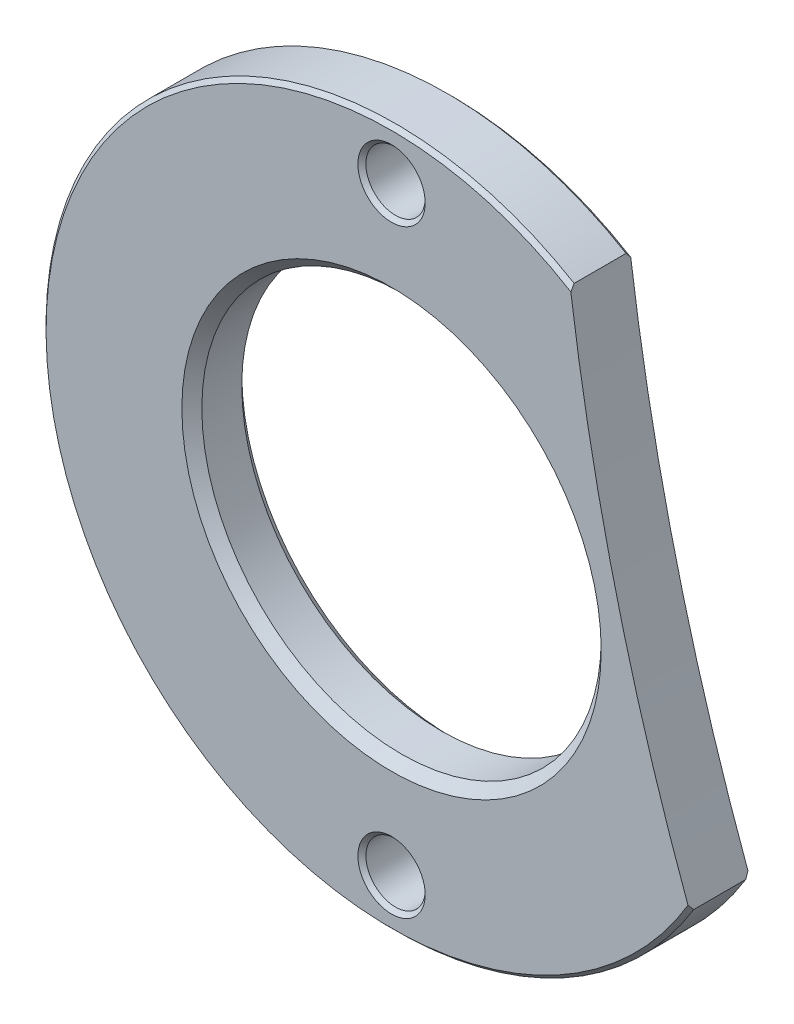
SolidWorks part; units mm, degrees
ref_plane "Plan de face" through (0, 0, 0) normal (0, 0, 1) x (1, 0, 0)
ref_plane "Plan de dessus" through (0, 0, 0) normal (0, 1, 0) x (1, 0, 0)
ref_plane "Plan de droite" through (0, 0, 0) normal (1, 0, 0) x (0, 0, -1)
sketch "Esquisse1" plane through (0, 0, 0) normal (0, 0, 1) x (1, 0, 0)
  circle A0 centre (0, 0) radius 10
  arc A1 (8.9458, 15.0407) -> (14.9354, -9.1206) centre (0, 0) ccw
  arc A2 (8.9458, 15.0407) -> (14.9354, -9.1206) centre (119, 29.5) ccw
  dimension "D1" = 20
  dimension "D2" = 35
  dimension "D5" = 222
  dimension "D3" = 119
  dimension "D4" = 29.5
extrude "Boss.-Extru.1" add sketch "Esquisse1" along normal blind 3
hole_wizard "Diamètre du perçage Ø2.9 (2.9)1" positions "Esquisse3" profile "Esquisse2" hole size "Ø2.9" standard "ISO"
sketch "Esquisse3" plane through (0, 0, 3) normal (0, 0, 1) x (1, 0, 0)
  line L0 (0, 15) -> (0, -15) construction
  point P0 (0, 15)
  point P1 (0, -15)
  dimension "D1" = 30
sketch "Esquisse2" plane through (0, 15, 3) normal (1, 0, 0) x (0, -1, 0)
  line L0 (0, 0) -> (0, 3)
  line L1 (0, 3) -> (1.485, 3)
  line L2 (1.485, 3) -> (1.485, 0)
  line L5 (1.485, 0) -> (0, 0)
  line L11 (0, -6.35) -> (0, 107.95) construction
  dimension "Diamètre du perçage jusqu'au prochain" = 2.97
  dimension "Profondeur du perçage jusqu'au prochain" = 3
chamfer "Chanfrein1" distance 0.5 angle 45 1 edges at (10, 0, 0)
chamfer "Chanfrein2" distance 0.2 angle 45 2 edges at (-16.9859, -4.2108, 0) (-16.9859, -4.2108, 3)
chamfer "Chanfrein3" distance 0.5 angle 45 1 edges at (10, 0, 3)
chamfer "Chanfrein4" distance 0.2 angle 45 4 edges at (1.485, -15, 3) (1.485, -15, 0) (1.485, 15, 3) (1.485, 15, 0)
other "Bloquer***"
